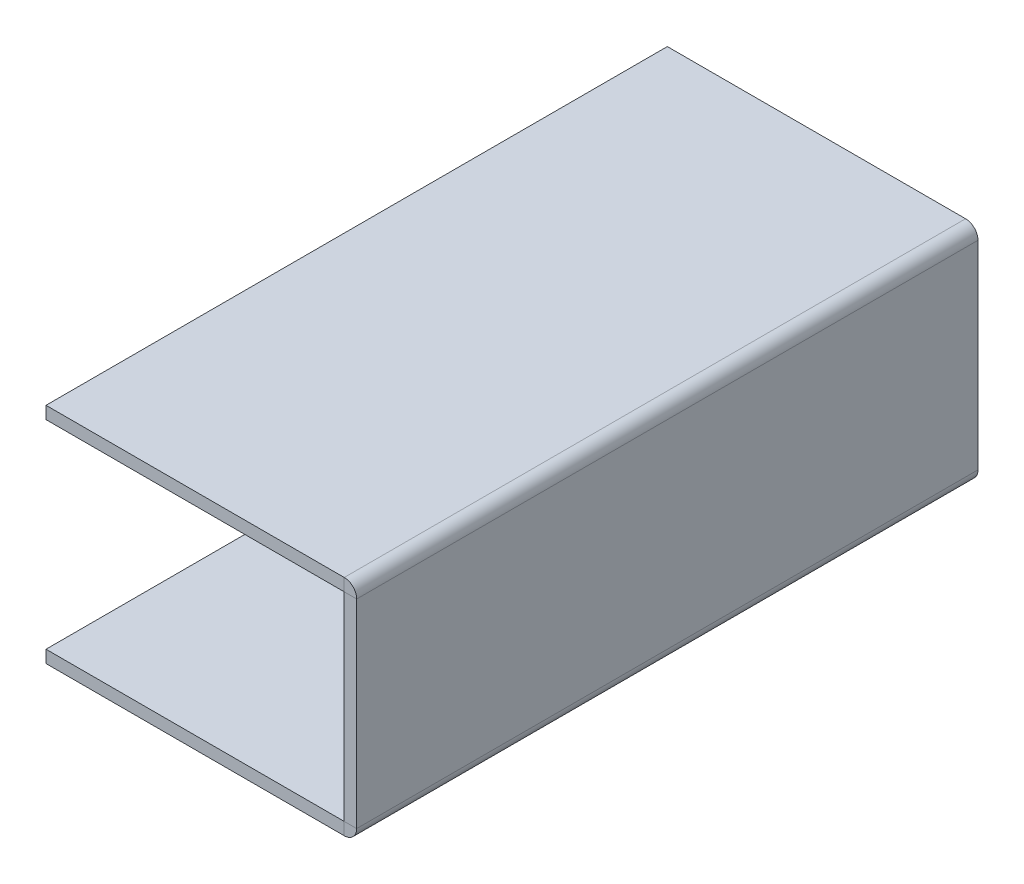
SolidWorks part; units mm, degrees
ref_plane "Front Plane" through (0, 0, 0) normal (0, 0, 1) x (1, 0, 0)
ref_plane "Top Plane" through (0, 0, 0) normal (0, 1, 0) x (1, 0, 0)
ref_plane "Right Plane" through (0, 0, 0) normal (1, 0, 0) x (0, 0, -1)
sketch "Sketch1" plane through (0, 0, 0) normal (0, 1, 0) x (1, 0, 0)
  line L1 (0, 0) -> (64, 0)
  line L2 (0, 0) -> (0, 50)
  line L3 (0, 50) -> (64, 50)
  line L4 (64, 0) -> (64, 50)
  dimension "D1" = 50
  dimension "D2" = 64
sheet metal parameters "Sheet-Metal1" thickness 1 parameters "D1"=0.0001
base flange "Base-Flange1" sketch "Sketch1" thickness 1 reverse thickness direction yes parameters "D1"=0.0001
sketch "Sketch3" plane through (0, 1, 0) normal (0, 1, 0) x (1, 0, 0)
  line L0 (24, 50) -> (24, 0)
  line L1 (64, 50) -> (0, 50) construction
  line L2 (0, 0) -> (64, 0) construction
  line L3 (40, 50) -> (40, 0)
  line L4 (64, 0) -> (64, 50) construction
  dimension "D1" = 24
  dimension "D2" = 16
sketched bend "Sketched Bend1" parameters "D1"=0
bend "SketchBend1" bend radius 0.0001 bend angle 90 parameters "D5"=1
bend "SketchBend2" bend radius 0 bend angle 90 parameters "D5"=2
flat pattern "Flat-Pattern1"
sketch "Bend-Lines1" plane through (0, 0, 0) normal (0, 1, 0) x (-1, 0, 0)
bend of the flat pattern "Flatten-<SketchBend1>1"
bend of the flat pattern "Flatten-<SketchBend2>1"
